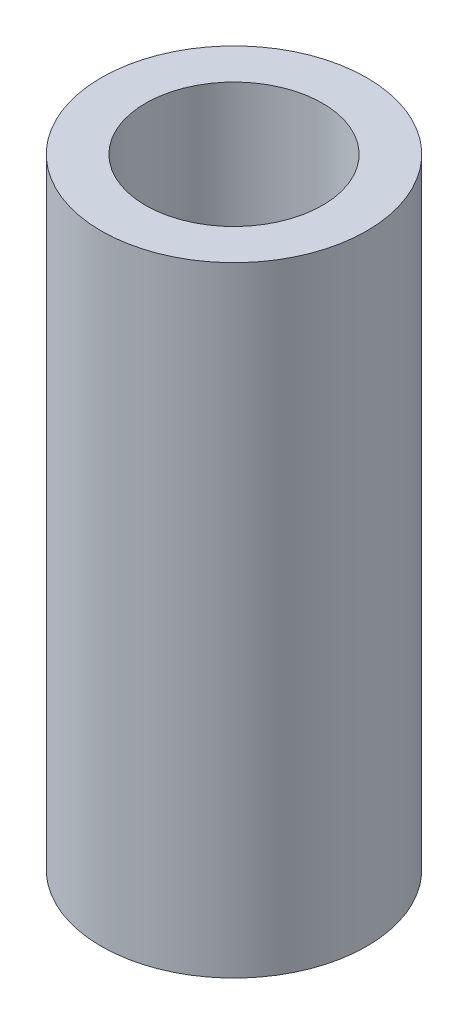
SolidWorks part; units mm, degrees
ref_plane "前视基准面" through (0, 0, 0) normal (0, 0, 1) x (1, 0, 0)
ref_plane "上视基准面" through (0, 0, 0) normal (0, 1, 0) x (1, 0, 0)
ref_plane "右视基准面" through (0, 0, 0) normal (1, 0, 0) x (0, 0, -1)
other "Configuration Table"
sketch "草图1" plane through (0, 0, 0) normal (0, 1, 0) x (1, 0, 0)
  circle A0 centre (0, 0) radius 7.5
  circle A1 centre (0, 0) radius 5
  dimension "D1" = 15
  dimension "D2" = 10
extrude "凸台-拉伸1" add sketch "草图1" along normal blind 35
